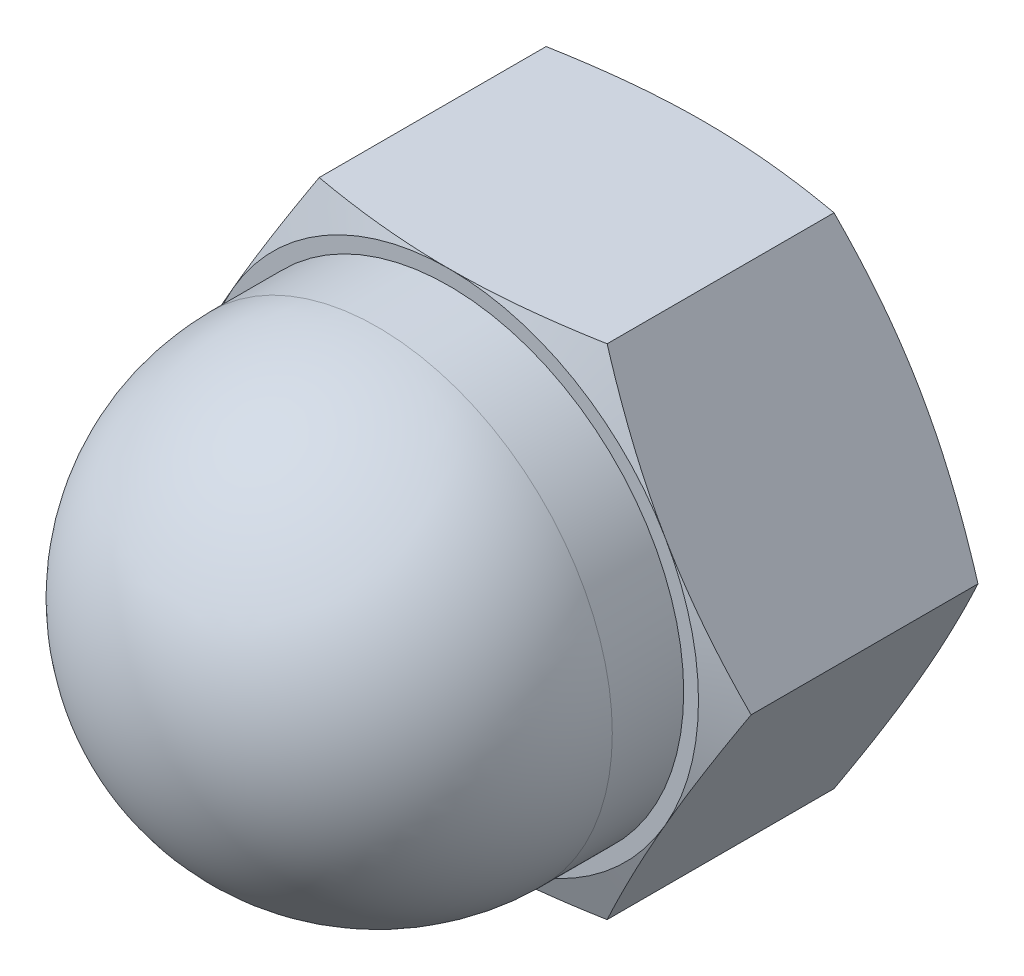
SolidWorks part; units mm, degrees
ref_plane "Front" through (0, 0, 0) normal (0, 0, 1) x (1, 0, 0)
ref_plane "Top" through (0, 0, 0) normal (0, 1, 0) x (1, 0, 0)
ref_plane "Right" through (0, 0, 0) normal (1, 0, 0) x (0, 0, -1)
sketch "Sketch1" plane through (0, 0, 0) normal (0, 0, 1) x (1, 0, 0)
  line L1 (5.6465, 0) -> (2.8232, 4.89)
  line L2 (2.8232, 4.89) -> (-2.8232, 4.89)
  line L3 (-2.8232, 4.89) -> (-5.6465, 0)
  line L4 (-5.6465, 0) -> (-2.8232, -4.89)
  line L5 (-2.8232, -4.89) -> (2.8232, -4.89)
  line L6 (2.8232, -4.89) -> (5.6465, 0)
  circle A0 centre (0, 0) radius 4.89 construction
  circle A1 centre (0, 0) radius 2.5
  dimension "d" = 5
  dimension "s" = 9.78
  dimension "e" = 11.293
extrude "BaseNut" add sketch "Sketch1" against normal blind 5
sketch "Sketch2" plane through (0, 0, 0) normal (0, 1, 0) x (1, 0, 0)
  line L0 (-4.89, 5) -> (-5.6465, 5)
  line L2 (-5.6465, 5) -> (-5.6465, 4.7247)
  line L4 (-5.6465, 4.7247) -> (-4.89, 5)
  line L5 (0, 3.3779) -> (0, -9.1399) construction
  line L7 (-7.1748, 2.5) -> (8.0192, 2.5) construction
  line L8 (-5.6465, 0.2753) -> (-4.89, 0)
  line L9 (-5.6465, 0) -> (-5.6465, 0.2753)
  line L10 (-4.89, 0) -> (-5.6465, 0)
  line L11 (-2.8232, 0) -> (-5.6465, 0) construction
  dimension "D1" = 9.78
  dimension "Angle" = 20
  dimension "h1" = 2.5
revolve "DoubleChamfer" cut sketch "Sketch2" angle 360 about L5
sketch "Sketch3" plane through (-4.6, 0, -6) normal (0, 1, 0) x (-1, 0, 0)
  line L1 (-9.2, 7.4) -> (-9.2, 6)
  line L3 (-4.6, 12) -> (-4.6, 0) construction
  line L4 (0.29, 6) -> (-9.49, 6) construction
  line L5 (-7.85, 6) -> (-9.2, 6)
  line L6 (-7.85, 8) -> (-7.85, 6)
  line L7 (-7.85, 8) -> (-4.6, 11)
  line L8 (-4.6, 12) -> (-4.6, 11)
  line L10 (-4.6, 1) -> (-0.3651, 1) construction
  arc A0 (-4.6, 12) -> (-9.2, 7.4) centre (-4.6, 7.4) ccw
  dimension "R" = 4.6
  dimension "m" = 11
  dimension "d1" = 6.5
  dimension "l" = 7
  dimension "h2" = 10
revolve "Crown" add sketch "Sketch3" angle 360 about L3
chamfer "EndChamfer" distance 0.65 angle 30 1 edges at (2.5, 0, -5)
sketch "Sketch4" plane through (0, 0, 0) normal (0, 1, 0) x (1, 0, 0)
  line L0 (0, 7.0607) -> (0, 2.3352) construction
  line L1 (2, 4.6) -> (2.5, 4.6)
  line L2 (2.5, 4.6) -> (2.933, 4.35)
  line L3 (2.933, 4.35) -> (2.5, 4.1)
  line L4 (2.5, 4.1) -> (2, 4.1)
  line L5 (2, 4.1) -> (2, 4.6)
  line L6 (-2.5, 4.35) -> (2.5, 4.35) construction
  dimension "D1" = 0.5
  dimension "D2" = 5
revolve "Cut-Revolve10" [suppressed] cut sketch "Sketch4" angle 360 about L0
pattern_linear "LPattern10" [suppressed] count 8 spacing 0.6 along (0, 0, 1)
equation "\"h1@Sketch2\" = \"h@BaseNut\" / 2"
equation "\"h2@Sketch3\" = \"m@Sketch3\"-1"
equation "\"D1@Sketch2\" =  \"s@Sketch1\""
equation "\"D2@Sketch4\" = \"d@Sketch1\""
equation "\"D1@Sketch4\" =  ( \"D2@ThreadCosmetic1\" - \"d@Sketch1\" )  / 2"
equation "\"D3@LPattern10\" = \"D1@Sketch4\" * 1.2"
equation "\"D1@LPattern10\" = \"h@BaseNut\" / \"D3@LPattern10\""
